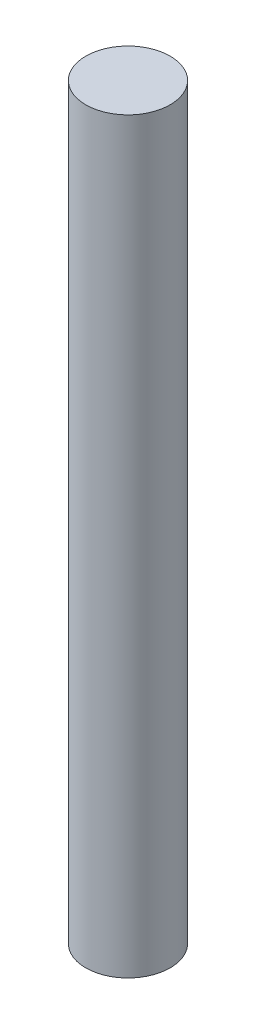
SolidWorks part; units mm, degrees
ref_plane "Спереди" through (0, 0, 0) normal (0, 0, 1) x (1, 0, 0)
ref_plane "Сверху" through (0, 0, 0) normal (0, 1, 0) x (1, 0, 0)
ref_plane "Справа" through (0, 0, 0) normal (1, 0, 0) x (0, 0, -1)
sketch "Эскиз1" plane through (0, 0, 0) normal (0, 1, 0) x (1, 0, 0)
  circle A0 centre (0, 0) radius 0.8065
  dimension "D1" = 1.6129
extrude "Бобышка-Вытянуть1" add sketch "Эскиз1" along normal mid plane 14.2875
